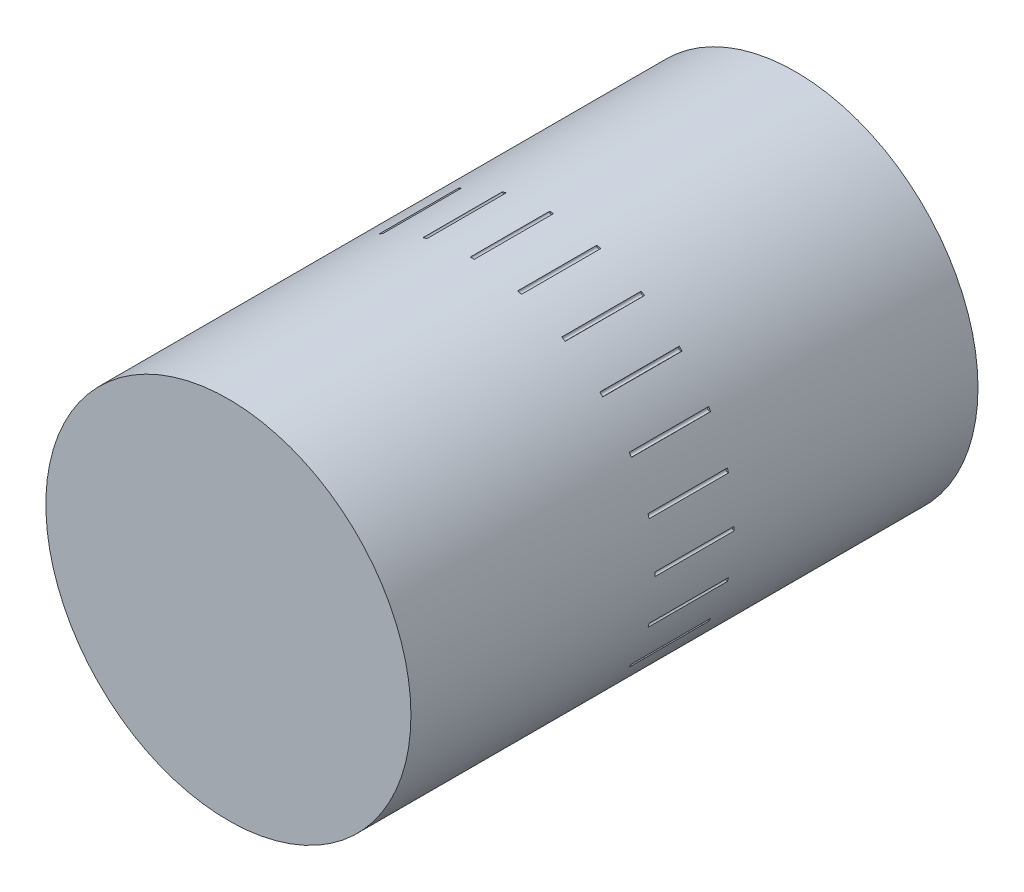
SolidWorks part; units mm, degrees
ref_plane "Ebene vorne" through (0, 0, 0) normal (0, 0, 1) x (1, 0, 0)
ref_plane "Ebene oben" through (0, 0, 0) normal (0, 1, 0) x (1, 0, 0)
ref_plane "Ebene rechts" through (0, 0, 0) normal (1, 0, 0) x (0, 0, -1)
sketch "Skizze1" plane through (0, 0, 0) normal (0, 0, 1) x (1, 0, 0)
  circle A0 centre (0, 0) radius 23.0165
extrude "Linear austragen1" add sketch "Skizze1" along normal mid plane 71.5
sketch "Skizze2" plane through (0, 0, 0) normal (0, 0, 1) x (1, 0, 0)
  arc A0 (-0.25, 23.0151) -> (0.25, 23.0151) centre (0, 23.0165) ccw
  circle A1 centre (0, 0) radius 23.0165 construction
  arc A2 (0.25, 23.0151) -> (-0.25, 23.0151) centre (0, 0) ccw
  dimension "D1" = 0.5
extrude "Schnitt-Linear austragen1" cut sketch "Skizze2" against normal mid plane 10
pattern_circular "Kreismuster1" count 24 over 360 about axis through (0, 0, 0) along (0, 0, 1) of "Schnitt-Linear austragen1"
equation "\"LÄNGE\"=0"
equation "\"BREITE\"=0"
equation "\"HÖHE\"=0"
equation "\"DURCHMESSER\"=0"
equation "\"Stückzahl\"= 1"
